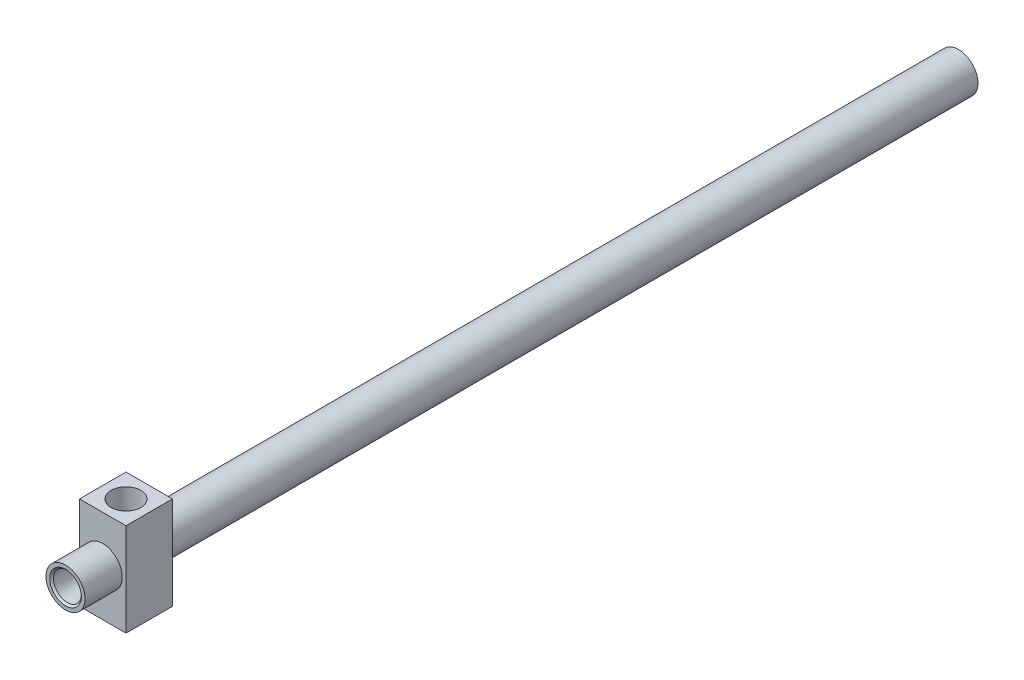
SolidWorks part; units mm, degrees
ref_plane "Face" through (0, 0, 0) normal (0, 0, 1) x (1, 0, 0)
ref_plane "Dessus" through (0, 0, 0) normal (0, 1, 0) x (1, 0, 0)
ref_plane "Droite" through (0, 0, 0) normal (1, 0, 0) x (0, 0, -1)
sketch "Esquisse1" plane through (0, 0, 0) normal (0, 0, 1) x (1, 0, 0)
  circle A0 centre (0, 0) radius 10.5
  dimension "D1" = 21
extrude "Base-Extrusion" add sketch "Esquisse1" against normal blind 435
sketch "Esquisse2" plane through (0, 0, 0) normal (0, 1, 0) x (1, 0, 0)
  line L1 (-12.5, 0) -> (12.5, 0)
  line L2 (-12.5, 0) -> (-12.5, -25)
  line L3 (-12.5, -25) -> (12.5, -25)
  line L4 (12.5, 0) -> (12.5, -25)
  dimension "D1" = 25
  dimension "D2" = 25
extrude "Boss.-Extru.1" add sketch "Esquisse2" along normal mid plane 50
sketch "Esquisse3" plane through (0, 25, 0) normal (0, 1, 0) x (-1, 0, 0)
  line L0 (12.5, 0) -> (-12.5, 25) construction
  circle A0 centre (0, 12.5) radius 8
  dimension "D1" = 16
extrude "Enlèv. mat.-Extru.1" cut sketch "Esquisse3" against normal blind 14.5
sketch "Esquisse6" plane through (0, -25, 0) normal (0, -1, 0) x (1, 0, 0)
  circle A0 centre (0, 12.5) radius 8
  circle A1 centre (0, 12.5) radius 8 construction
extrude "Enlèv. mat.-Extru.4" cut sketch "Esquisse6" against normal blind 14.5
sketch "Esquisse7" plane through (0, -25, 0) normal (0, -1, 0) x (1, 0, 0)
  circle A0 centre (0, 12.5) radius 5
  dimension "D1" = 10
extrude "Enlèv. mat.-Extru.5" cut sketch "Esquisse7" against normal through all
sketch "Esquisse4" plane through (0, 0, 25) normal (0, 0, 1) x (1, 0, 0)
  circle A0 centre (0, 0) radius 10.5
  circle A1 centre (0, 0) radius 10.5 construction
extrude "Boss.-Extru.2" add sketch "Esquisse4" along normal blind 20
sketch "Esquisse5" plane through (0, 0, 45) normal (0, 0, 1) x (1, 0, 0)
  circle A0 centre (0, 0) radius 7.5
  circle A1 centre (0, 0) radius 10.5 construction
  dimension "D1" = 15
extrude "Enlèv. mat.-Extru.2" cut sketch "Esquisse5" against normal through all
chamfer "Chanfrein1" distance 1 angle 45 2 edges at (7.5, 0, -435) (7.5, 0, 45)
